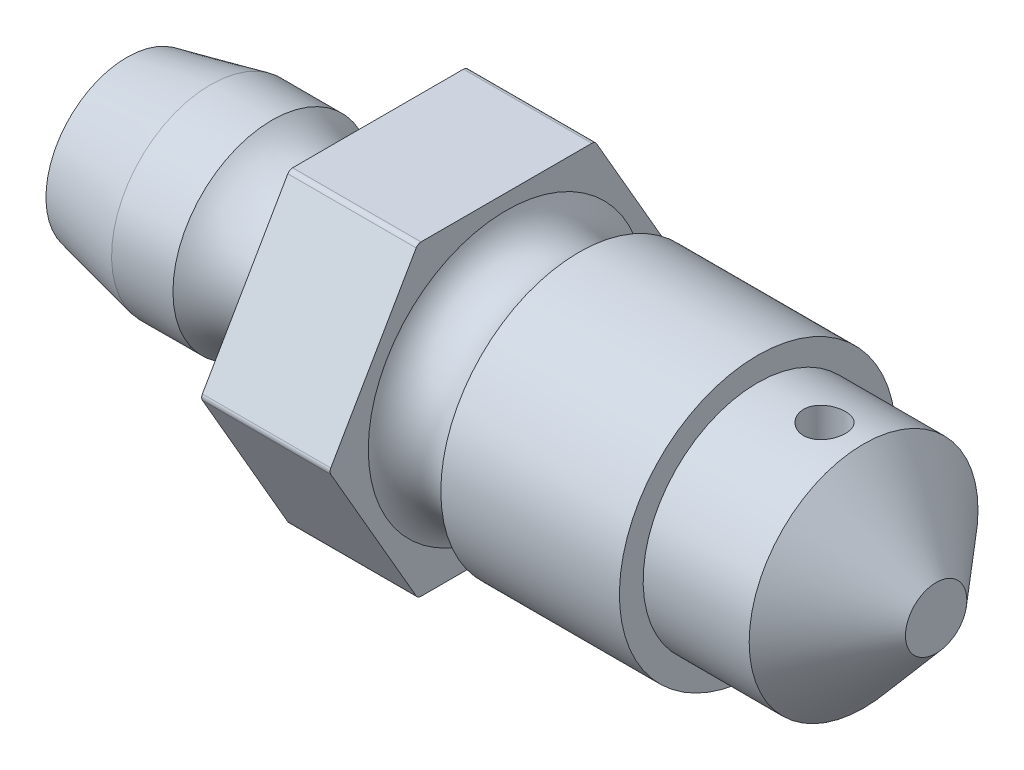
SolidWorks part; units mm, degrees
ref_plane "正面" through (0, 0, 0) normal (0, 0, 1) x (1, 0, 0)
ref_plane "平面" through (0, 0, 0) normal (0, 1, 0) x (1, 0, 0)
ref_plane "右側面" through (0, 0, 0) normal (1, 0, 0) x (0, 0, -1)
sketch "ｽｹｯﾁ1" plane through (0, 0, 0) normal (0, 0, 1) x (1, 0, 0)
  line L0 (0, 0) -> (0, 2.9)
  line L1 (0, 2.9) -> (3, 3.55)
  line L2 (3, 3.55) -> (9, 3.55)
  line L3 (9, 3.55) -> (9, 6.5)
  line L4 (9, 6.5) -> (13.6, 6.5)
  line L5 (13.6, 6.5) -> (13.6, 4.95)
  line L6 (13.6, 4.95) -> (22.6, 4.95)
  line L7 (22.6, 4.95) -> (22.6, 4.1)
  line L8 (22.6, 4.1) -> (26.4, 4.1)
  line L9 (26.4, 4.1) -> (29, 1.1)
  line L10 (29, 1.1) -> (29, 0)
  line L11 (29, 0) -> (0, 0)
  point P14 (29, 0.55)
  dimension "D1" = 3.55
  dimension "D2" = 9
  dimension "D3" = 3
  dimension "D4" = 2.9
  dimension "D5" = 4.6
  dimension "D6" = 6.5
  dimension "D7" = 4.95
  dimension "D8" = 9
  dimension "D9" = 4.1
  dimension "D10" = 1.1
  dimension "D11" = 29
  dimension "D12" = 2.6
revolve "回転1" add sketch "ｽｹｯﾁ1" angle 360 about L11
sketch "ｽｹｯﾁ2" plane through (0, 0, 0) normal (0, 1, 0) x (1, 0, 0)
  line L3 (0, 0) -> (30.0984, 0) construction
  line L6 (13.6, -6.5) -> (13.6, 6.5) construction
  line L7 (7.1, 5.5817) -> (7.1, 0) construction
  line L8 (7.1, 2.8) -> (4.7586, 2.8) construction
  line L9 (5.2, 3.55) -> (5.2, 6.5)
  line L10 (5.2, 6.5) -> (9, 6.5)
  line L11 (9, 6.5) -> (9, 3.55)
  line L12 (9, 6.5) -> (9, -6.5) construction
  line L13 (9, 3.55) -> (3, 3.55) construction
  line L14 (9, 3.55) -> (3, 3.55) construction
  line L16 (13.6, 6.5) -> (9, 6.5) construction
  line L18 (14.9, 4.05) -> (17.1865, 4.05) construction
  line L19 (13.6, 4.95) -> (13.6, 6.5)
  line L20 (13.6, 6.5) -> (16.2, 6.5)
  line L21 (16.2, 6.5) -> (16.2, 4.95)
  line L22 (22.6, 4.95) -> (13.6, 4.95) construction
  line L23 (14.9, 6.5) -> (14.9, 5.4389) construction
  line L24 (13.6, 6.5) -> (9, 6.5) construction
  arc A0 (5.2, 3.55) -> (9, 3.55) centre (7.1, 5.5817) ccw
  arc A1 (13.6, 4.95) -> (16.2, 4.95) centre (14.9, 5.4389) ccw
  dimension "D1" = 3.8
  dimension "D2" = 2.6
  dimension "D3" = 2.8
  dimension "D4" = 4.05
revolve "ｶｯﾄ - 回転1" cut sketch "ｽｹｯﾁ2" angle 360 about L3
hole_wizard "Ø3.0 (3) 直径の穴1" positions "ｽｹｯﾁ3" profile "ｽｹｯﾁ4" hole size "Ø3.0" standard "JIS"
sketch "ｽｹｯﾁ3" plane through (0, 0, 0) normal (-1, 0, 0) x (0, 0, 1)
  point P0 (0, 0)
sketch "ｽｹｯﾁ4" plane through (0, 0, 0) normal (0, 1, 0) x (0, 0, 1)
  line L0 (0, 0) -> (0, 27.4013)
  line L1 (0, 27.4013) -> (1.5, 26.5)
  line L2 (1.5, 26.5) -> (1.5, 0)
  line L5 (1.5, 0) -> (0, 0)
  line L10 (0, 27.4013) -> (-1.5, 26.5) construction
  line L11 (0, -6.35) -> (0, 107.95) construction
  dimension "穴の直径" = 3
  dimension "穴の深さ" = 26.5
  dimension "ﾄﾞﾘﾙ角度" = 118
hole_wizard "Ø1.5 (1.5) 直径の穴1" positions "3Dｽｹｯﾁ1" profile "ｽｹｯﾁ7" hole size "Ø1.5" standard "JIS"
sketch3d "3Dｽｹｯﾁ1"
  line L0 (29, 0, 0) -> (29, 4.1, 0) construction
  line L1 (26.4, 0, 0) -> (29, 0, 0) construction
  line L2 (29, 4.1, 0) -> (21.4338, 4.1, 0) construction
  point P0 (25, 4.1, 0)
  dimension "D1" = 4
sketch "ｽｹｯﾁ7" plane through (25, 4.1, 0) normal (1, 0, 0) x (0, 0, 1)
  line L0 (0, 0) -> (0, 10.6)
  line L1 (0, 10.6) -> (0.75, 10.6)
  line L2 (0.75, 10.6) -> (0.75, 0)
  line L5 (0.75, 0) -> (0, 0)
  line L11 (0, -6.35) -> (0, 107.95) construction
  dimension "通し穴の直径" = 1.5
  dimension "通し穴の深さ" = 10.6
sketch "ｽｹｯﾁ8" plane through (9, 0, 0) normal (-1, 0, 0) x (0, 0, 1)
  line L1 (6.3509, 0) -> (3.1754, 5.5)
  line L2 (3.1754, 5.5) -> (-3.1754, 5.5)
  line L3 (-3.1754, 5.5) -> (-6.3509, 0)
  line L4 (-6.3509, 0) -> (-3.1754, -5.5)
  line L5 (-3.1754, -5.5) -> (3.1754, -5.5)
  line L6 (3.1754, -5.5) -> (6.3509, 0)
  circle A0 centre (0, 0) radius 5.5 construction
  dimension "D1" = 11
extrude "ｶｯﾄ - 押し出し1" cut sketch "ｽｹｯﾁ8" against normal through all flip side to cut
fillet "ﾌｨﾚｯﾄ1" radius 0.2 6 edges at (11.3, 5.5, -3.1754) (11.3, 5.5, 3.1754) (11.3, 0, 6.3509) (11.3, -5.5, 3.1754) (11.3, -5.5, -3.1754) (11.3, 0, -6.3509)
